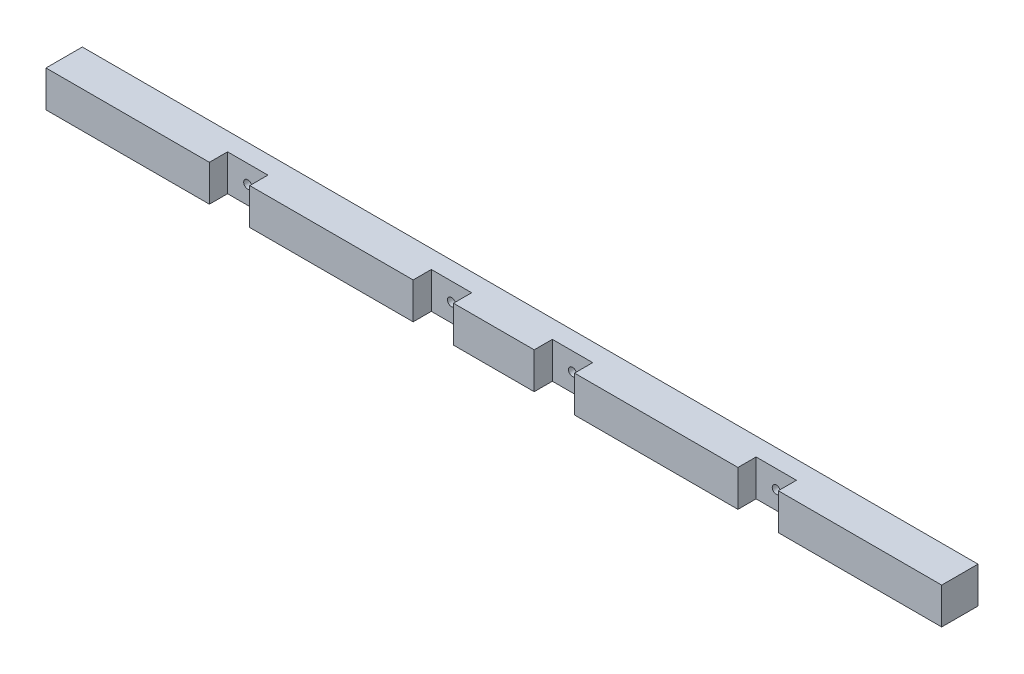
SolidWorks part; units mm, degrees
ref_plane "Plan de face" through (0, 0, 0) normal (0, 0, 1) x (1, 0, 0)
ref_plane "Plan de dessus" through (0, 0, 0) normal (0, 1, 0) x (1, 0, 0)
ref_plane "Plan de droite" through (0, 0, 0) normal (1, 0, 0) x (0, 0, -1)
sketch "Esquisse1" plane through (0, 0, 0) normal (0, 0, 1) x (1, 0, 0)
  line L1 (0, 0) -> (222, 0)
  line L2 (0, 0) -> (0, 9)
  line L3 (0, 9) -> (222, 9)
  line L4 (222, 0) -> (222, 9)
  dimension "D1" = 222
  dimension "D2" = 9
extrude "Extrusion1" add sketch "Esquisse1" along normal blind 9
sketch "Esquisse2" plane through (0, 0, 9) normal (0, 0, 1) x (1, 0, 0)
  line L0 (222, 9) -> (0, 9) construction
  line L1 (40.5, 9) -> (50.5, 9)
  line L2 (40.5, 9) -> (40.5, 0)
  line L3 (40.5, 0) -> (50.5, 0)
  line L4 (50.5, 9) -> (50.5, 0)
  line L5 (0, 0) -> (222, 0) construction
  dimension "D1" = 40.5
  dimension "D2" = 10
extrude "Enlèv. mat.-Extru.1" cut sketch "Esquisse2" against normal blind 4.5
sketch "Esquisse3" plane through (0, 0, 4.5) normal (0, 0, 1) x (1, 0, 0)
  line L0 (40.5, 9) -> (40.5, 0) construction
  line L1 (40.5, 0) -> (50.5, 0) construction
  circle A0 centre (45.5, 4.5) radius 1
  dimension "D3" = 2
  dimension "D1" = 5
  dimension "D2" = 4.5
extrude "Enlèv. mat.-Extru.2" cut sketch "Esquisse3" against normal blind 4.5
sketch "Esquisse4" plane through (0, 0, 9) normal (0, 0, 1) x (1, 0, 0)
  line L0 (50.5, 0) -> (222, 0) construction
  line L1 (91, 0) -> (101, 0)
  line L2 (91, 0) -> (91, 9)
  line L3 (91, 9) -> (101, 9)
  line L4 (101, 0) -> (101, 9)
  line L5 (222, 9) -> (50.5, 9) construction
  dimension "D1" = 40.5
  dimension "D2" = 10
extrude "Enlèv. mat.-Extru.3" cut sketch "Esquisse4" against normal blind 4.5
sketch "Esquisse5" plane through (0, 0, 4.5) normal (0, 0, 1) x (1, 0, 0)
  line L0 (91, 9) -> (91, 0) construction
  line L1 (101, 9) -> (91, 9) construction
  circle A0 centre (96, 4.5) radius 1
  dimension "D3" = 2
  dimension "D1" = 5
  dimension "D2" = 4.5
extrude "Enlèv. mat.-Extru.4" cut sketch "Esquisse5" against normal blind 4.5
sketch "Esquisse6" plane through (0, 0, 9) normal (0, 0, 1) x (1, 0, 0)
  line L0 (101, 0) -> (222, 0) construction
  line L1 (121, 0) -> (131, 0)
  line L2 (121, 0) -> (121, 9)
  line L3 (121, 9) -> (131, 9)
  line L4 (131, 0) -> (131, 9)
  line L5 (222, 9) -> (101, 9) construction
  dimension "D1" = 20
  dimension "D2" = 10
extrude "Enlèv. mat.-Extru.5" cut sketch "Esquisse6" against normal blind 4.5
sketch "Esquisse7" plane through (0, 0, 4.5) normal (0, 0, 1) x (1, 0, 0)
  line L0 (121, 9) -> (121, 0) construction
  line L1 (131, 9) -> (121, 9) construction
  circle A0 centre (126, 4.5) radius 1
  dimension "D3" = 2
  dimension "D1" = 5
  dimension "D2" = 4.5
extrude "Enlèv. mat.-Extru.6" cut sketch "Esquisse7" against normal blind 4.5
sketch "Esquisse8" plane through (0, 0, 9) normal (0, 0, 1) x (1, 0, 0)
  line L1 (171.5, 0) -> (181.5, 0)
  line L2 (171.5, 0) -> (171.5, 9)
  line L3 (171.5, 9) -> (181.5, 9)
  line L4 (181.5, 0) -> (181.5, 9)
  dimension "D1" = 10
  dimension "D2" = 40.5
extrude "Enlèv. mat.-Extru.7" cut sketch "Esquisse8" against normal blind 4.5
sketch "Esquisse9" plane through (0, 0, 4.5) normal (0, 0, 1) x (1, 0, 0)
  line L0 (171.5, 9) -> (171.5, 0) construction
  line L1 (181.5, 9) -> (171.5, 9) construction
  circle A0 centre (176.5, 4.5) radius 1
  dimension "D3" = 2
  dimension "D1" = 5
  dimension "D2" = 4.5
extrude "Enlèv. mat.-Extru.8" cut sketch "Esquisse9" against normal blind 4.5
